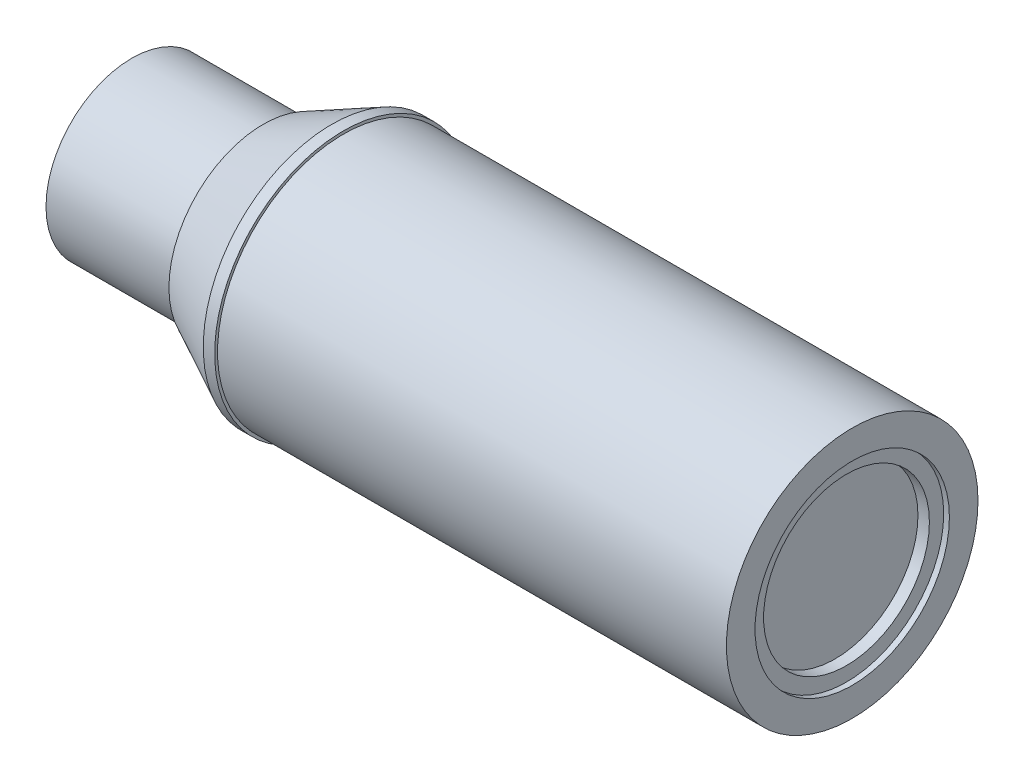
SolidWorks part; units mm, degrees
ref_plane "Front" through (0, 0, 0) normal (0, 0, 1) x (1, 0, 0)
ref_plane "Top" through (0, 0, 0) normal (0, 1, 0) x (1, 0, 0)
ref_plane "Right" through (0, 0, 0) normal (1, 0, 0) x (0, 0, -1)
sketch "Sketch1" plane through (0, 0, 0) normal (1, 0, 0) x (0, 0, -1)
  circle A0 centre (0, 0) radius 15
  dimension "D1" = 30
extrude "Boss-Extrude1" add sketch "Sketch1" along normal blind 23
sketch "Sketch3" plane through (23, 0, 0) normal (1, 0, 0) x (0, 0, -1)
  circle A0 centre (0, 0) radius 16.5
  dimension "D1" = 33
ref_plane "Plane1" through (35, 0, 0) normal (1, 0, 0) x (0, 0, -1)
sketch "Sketch4" plane through (35, 0, 0) normal (1, 0, 0) x (0, 0, -1)
  circle A0 centre (0, 0) radius 22.5
  dimension "D1" = 45
loft "Loft1" add profiles "Sketch3", "Sketch4"
sketch "Sketch5" plane through (35, 0, 0) normal (1, 0, 0) x (0, 0, -1)
  circle A0 centre (0, 0) radius 22.5
extrude "Boss-Extrude2" add sketch "Sketch5" along normal blind 2
sketch "Sketch6" plane through (37, 0, 0) normal (1, 0, 0) x (0, 0, -1)
  circle A0 centre (0, 0) radius 22
  dimension "D1" = 44
extrude "Boss-Extrude3" add sketch "Sketch6" along normal blind 89
sketch "Sketch7" plane through (126, 0, 0) normal (1, 0, 0) x (0, 0, -1)
  circle A0 centre (0, 0) radius 17
  dimension "D1" = 34
extrude "Cut-Extrude1" cut sketch "Sketch7" against normal blind 1
sketch "Sketch8" plane through (125, 0, 0) normal (1, 0, 0) x (0, 0, -1)
  circle A0 centre (0, 0) radius 14.5
  dimension "D1" = 29
extrude "Cut-Extrude2" cut sketch "Sketch8" against normal blind 2
